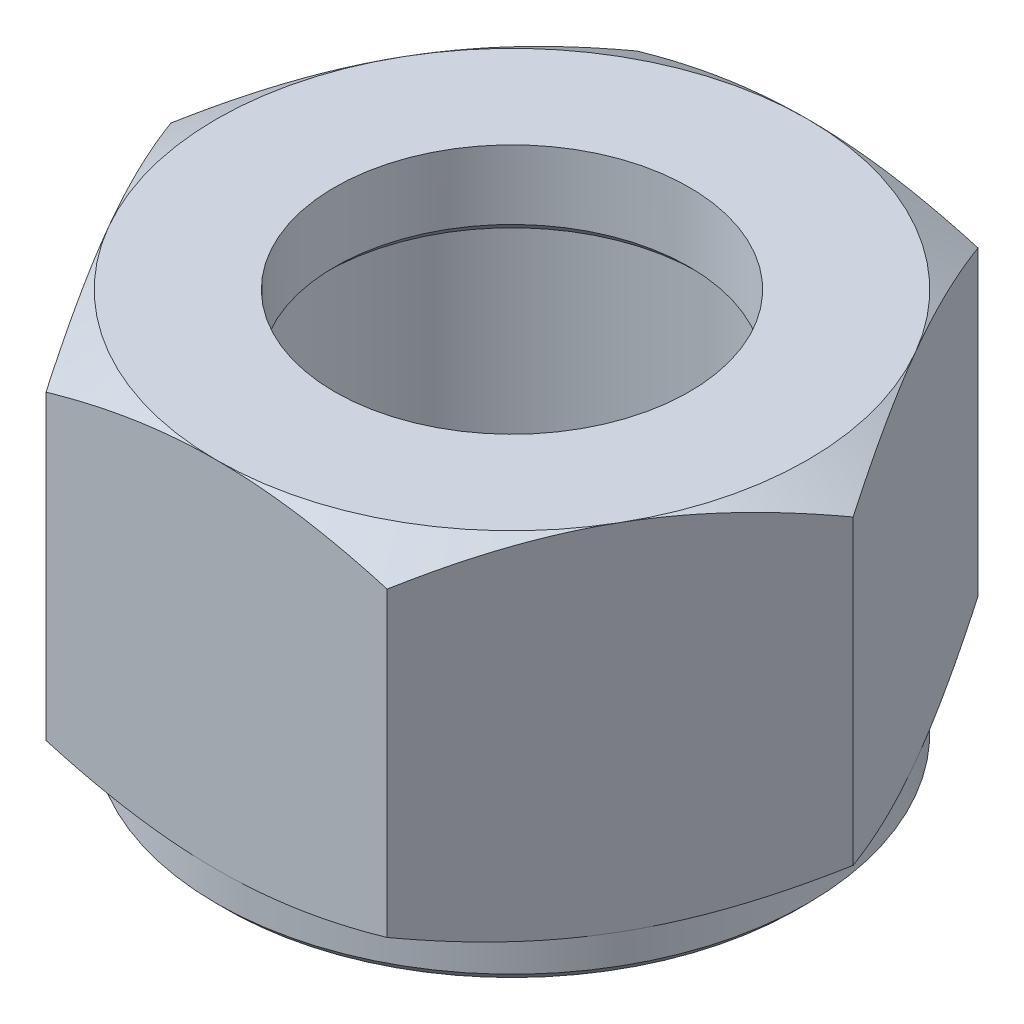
SolidWorks part; units mm, degrees
ref_plane "Přední rovina" through (0, 0, 0) normal (0, 0, 1) x (1, 0, 0)
ref_plane "Horní rovina" through (0, 0, 0) normal (0, 1, 0) x (1, 0, 0)
ref_plane "Pravá rovina" through (0, 0, 0) normal (1, 0, 0) x (0, 0, -1)
sketch "Skica1" plane through (0, 0, 0) normal (0, 1, 0) x (1, 0, 0)
  line L1 (17.3205, 0) -> (8.6603, 15)
  line L2 (8.6603, 15) -> (-8.6603, 15)
  line L3 (-8.6603, 15) -> (-17.3205, 0)
  line L4 (-17.3205, 0) -> (-8.6603, -15)
  line L5 (-8.6603, -15) -> (8.6603, -15)
  line L6 (8.6603, -15) -> (17.3205, 0)
  circle A0 centre (0, 0) radius 15 construction
extrude "Přidat vysunutím1" add sketch "Skica1" along normal blind 18
sketch "Skica2" plane through (0, 18, 0) normal (0, 1, 0) x (-1, 0, 0)
  circle A0 centre (0, 0) radius 15
extrude "Odebrat vysunutím1" cut sketch "Skica2" against normal blind 18 draft 60 flip side to cut
sketch "Skica3" plane through (0, 0, 0) normal (0, -1, 0) x (1, 0, 0)
  circle A0 centre (0, 0) radius 15
extrude "Odebrat vysunutím2" cut sketch "Skica3" against normal blind 18 draft 60 flip side to cut
sketch "Skica4" plane through (0, 0, 0) normal (0, -1, 0) x (1, 0, 0)
  circle A0 centre (0, 0) radius 15
extrude "Přidat vysunutím2" add sketch "Skica4" along normal blind 2
chamfer "Zkosení1" distance 0.5 angle 45 1 edges at (0, -2, -15)
sketch "Skica5" plane through (0, -2, 0) normal (0, -1, 0) x (1, 0, 0)
  circle A0 centre (0, 0) radius 11
extrude "Odebrat vysunutím3" cut sketch "Skica5" against normal blind 16
sketch "Skica6" plane through (0, 18, 0) normal (0, 1, 0) x (1, 0, 0)
  circle A0 centre (0, 0) radius 9
extrude "Odebrat vysunutím4" cut sketch "Skica6" against normal up to next
chamfer "Zkosení2" distance 0.5 angle 45 1 edges at (0, 14, -9)
